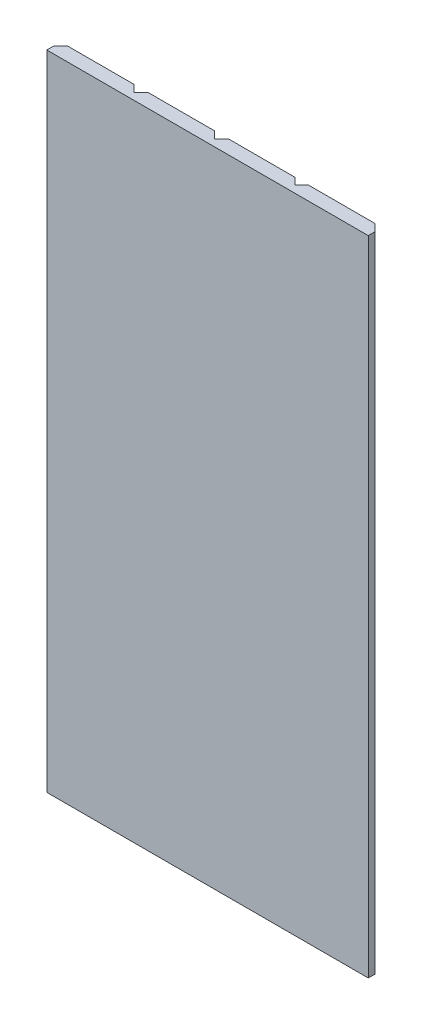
SolidWorks part; units mm, degrees
ref_plane "Front Plane" through (0, 0, 0) normal (0, 0, 1) x (1, 0, 0)
ref_plane "Top Plane" through (0, 0, 0) normal (0, 1, 0) x (1, 0, 0)
ref_plane "Right Plane" through (0, 0, 0) normal (1, 0, 0) x (0, 0, -1)
sketch "Sketch1" plane through (0, 0, 0) normal (0, 0, 1) x (1, 0, 0)
  line L1 (-290, 580) -> (290, 580)
  line L2 (-290, 580) -> (-290, -580)
  line L3 (-290, -580) -> (290, -580)
  line L4 (290, 580) -> (290, -580)
  point P4 (-290, 0)
  point P6 (0, 580)
  dimension "D1" = 580
  dimension "D2" = 1160
extrude "Boss-Extrude1" add sketch "Sketch1" along normal blind 25
sketch "Sketch3" plane through (0, 580, 0) normal (0, 1, 0) x (1, 0, 0)
  line L0 (-290, -12.5) -> (-321.8198, 19.3198)
  line L1 (-290, -12.5) -> (-258.1802, 19.3198)
  line L2 (-258.1802, 19.3198) -> (-321.8198, 19.3198)
  line L3 (-290, 0) -> (-290, -25) construction
  line L4 (-290, -25) -> (-290, 0) construction
  line L5 (290, 0) -> (-290, 0) construction
  line L6 (290, -25) -> (-290, -25) construction
  point P9 (-290, -12.5)
  dimension "D1" = 90
  dimension "D2" = 45
extrude "Cut-Extrude1" cut sketch "Sketch3" against normal up to surface (1160 mm away) contours L0 L2 L1
pattern_linear "LPattern1" count 5 spacing 145 along (0.7071, 0, 0.7071) of "Cut-Extrude1"
